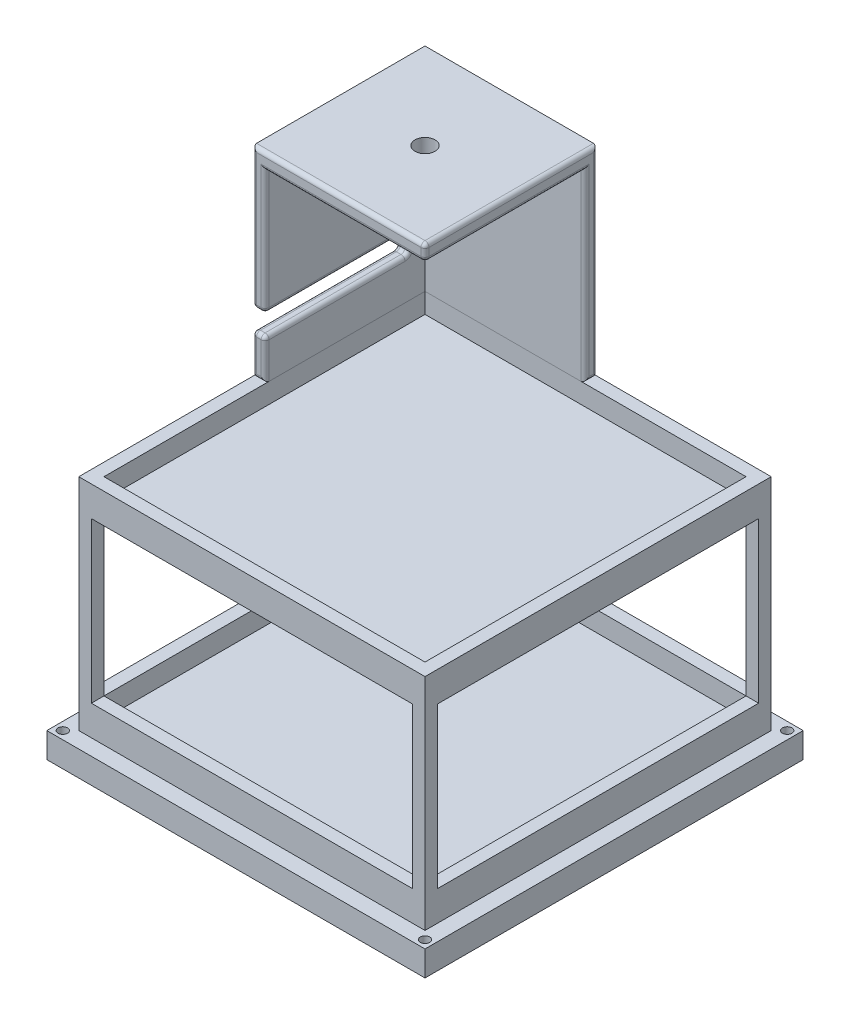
SolidWorks part; units mm, degrees
ref_plane "Front Plane" through (0, 0, 0) normal (0, 0, 1) x (1, 0, 0)
ref_plane "Top Plane" through (0, 0, 0) normal (0, 1, 0) x (1, 0, 0)
ref_plane "Right Plane" through (0, 0, 0) normal (1, 0, 0) x (0, 0, -1)
sketch "Sketch1" plane through (0, 0, 0) normal (0, 1, 0) x (1, 0, 0)
  line L1 (-55, -55) -> (55, -55)
  line L2 (-55, -55) -> (-55, 55)
  line L3 (-55, 55) -> (55, 55)
  line L4 (55, -55) -> (55, 55)
  line L5 (-55, -55) -> (55, 55) construction
  line L6 (-55, 55) -> (55, -55) construction
  point P0 (0, 0)
  dimension "D1" = 110
  dimension "D2" = 110
extrude "Boss-Extrude1" add sketch "Sketch1" along normal blind 9.525
sketch "Sketch3" plane through (0, 0, 0) normal (0, -1, 0) x (1, 0, 0)
  line L0 (55, 55) -> (55, -55) construction
  line L1 (-60.08, -60.08) -> (60.08, -60.08)
  line L2 (-60.08, -60.08) -> (-60.08, 60.08)
  line L3 (-60.08, 60.08) -> (60.08, 60.08)
  line L4 (60.08, -60.08) -> (60.08, 60.08)
  line L5 (-60.08, -60.08) -> (60.08, 60.08) construction
  line L6 (-60.08, 60.08) -> (60.08, -60.08) construction
  line L7 (-55, 55) -> (55, 55) construction
  point P0 (0, 0)
  dimension "D1" = 5.08
  dimension "D2" = 5.08
extrude "Boss-Extrude2" add sketch "Sketch3" along normal blind 8
sketch "Sketch4" plane through (0, 0, 0) normal (0, 1, 0) x (1, 0, 0)
  line L0 (-60.08, 60.08) -> (-55, 60.08) construction
  line L1 (-55, 55) -> (-55, 60.08) construction
  line L2 (-60.08, 60.08) -> (60.08, 60.08) construction
  line L3 (0, -5.2388) -> (0, 5.2388) construction
  line L4 (55, 55) -> (55, 60.08) construction
  line L5 (60.08, 60.08) -> (55, 60.08) construction
  line L6 (-5.2388, 0) -> (5.2388, 0) construction
  line L7 (60.08, -60.08) -> (55, -60.08) construction
  line L8 (55, -55) -> (55, -60.08) construction
  line L9 (-55, -55) -> (-55, -60.08) construction
  line L10 (-60.08, -60.08) -> (-55, -60.08) construction
  circle A0 centre (-57.54, 57.54) radius 1.5
  circle A1 centre (57.54, 57.54) radius 1.5
  circle A2 centre (57.54, -57.54) radius 1.5
  circle A3 centre (-57.54, -57.54) radius 1.5
  point P10 (-57.54, 60.08)
  point P11 (-55, 57.54)
  dimension "D1" = 3
extrude "Cut-Extrude2" cut sketch "Sketch4" against normal through all
sketch "Sketch2" plane through (0, 9.525, 0) normal (0, 1, 0) x (1, 0, 0)
  line L1 (-51, -51) -> (51, -51)
  line L2 (-51, -51) -> (-51, 51)
  line L3 (-51, 51) -> (51, 51)
  line L4 (51, -51) -> (51, 51)
  line L5 (-51, -51) -> (51, 51) construction
  line L6 (-51, 51) -> (51, -51) construction
  point P0 (0, 0)
  dimension "D1" = 102
  dimension "D2" = 102
extrude "Cut-Extrude1" cut sketch "Sketch2" against normal blind 6.35
sketch "Sketch5" plane through (0, 9.525, 0) normal (0, 1, 0) x (1, 0, 0)
  line L0 (-5.2388, 0) -> (5.2388, 0) construction
  line L1 (-55, 55) -> (-51, 55)
  line L2 (-55, 55) -> (-55, 51)
  line L3 (-55, 51) -> (-51, 51)
  line L4 (-51, 55) -> (-51, 51)
  line L5 (-55, -51) -> (-51, -51)
  line L6 (-51, -55) -> (-51, -51)
  line L7 (-55, -55) -> (-51, -55)
  line L8 (-55, -55) -> (-55, -51)
  line L9 (0, -5.2388) -> (0, 5.2388) construction
  line L10 (55, -55) -> (55, -51)
  line L11 (55, -55) -> (51, -55)
  line L12 (51, -55) -> (51, -51)
  line L13 (55, -51) -> (51, -51)
  line L14 (55, 51) -> (51, 51)
  line L15 (51, 55) -> (51, 51)
  line L16 (55, 55) -> (51, 55)
  line L17 (55, 55) -> (55, 51)
extrude "Boss-Extrude3" add sketch "Sketch5" along normal blind 50.8
sketch "Sketch6" plane through (0, 60.325, 0) normal (0, 1, 0) x (1, 0, 0)
  line L1 (-55, 55) -> (55, 55)
  line L2 (-55, 55) -> (-55, -55)
  line L3 (-55, -55) -> (55, -55)
  line L4 (55, 55) -> (55, -55)
extrude "Boss-Extrude4" add sketch "Sketch6" along normal blind 9.525
sketch "Sketch7" plane through (0, 69.85, 0) normal (0, 1, 0) x (1, 0, 0)
  line L8 (-51, -51) -> (51, -51)
  line L9 (-51, -51) -> (-51, 51)
  line L10 (-51, 51) -> (51, 51)
  line L11 (51, -51) -> (51, 51)
  line L12 (-51, -51) -> (51, 51) construction
  line L13 (-51, 51) -> (51, -51) construction
  point P0 (0, 0)
  dimension "D1" = 102
  dimension "D2" = 102
extrude "Cut-Extrude3" cut sketch "Sketch7" against normal blind 6.35
sketch "Sketch8" plane through (0, 69.85, 0) normal (0, 1, 0) x (1, 0, 0)
  line L0 (-55, 0.2) -> (-51, 0.2)
  line L1 (-51, 51) -> (-51, -51) construction
  line L2 (-51, 0.2) -> (-51, 51)
  line L3 (-51, 51) -> (-0.2, 51)
  line L4 (-55, 55) -> (-55, -55)
  line L5 (-55, -55) -> (55, -55)
  line L6 (55, -55) -> (55, 55)
  line L7 (55, 55) -> (-55, 55)
  line L8 (-55, 55) -> (-55, 0.2)
  line L11 (-0.2, 55) -> (-55, 55)
  line L12 (51, 51) -> (-51, 51) construction
  line L13 (-0.2, 51) -> (-0.2, 55)
  dimension "D2" = 50.8
  dimension "D3" = 50.8
  dimension "D1" = 0
extrude "Boss-Extrude5" add sketch "Sketch8" along normal blind 63.5 separate body
sketch "Sketch10" plane through (0, 133.35, 0) normal (0, 1, 0) x (1, 0, 0)
  line L0 (-0.2, 51) -> (-0.2, 55) construction
  line L1 (-55, 55) -> (-0.2, 55)
  line L2 (-55, 55) -> (-55, 0.2)
  line L3 (-55, 0.2) -> (-0.2, 0.2)
  line L4 (-0.2, 55) -> (-0.2, 0.2)
  line L5 (-55, 0.2) -> (-51, 0.2) construction
extrude "Boss-Extrude6" add sketch "Sketch10" against normal blind 5
sketch "Sketch11" plane through (0, 133.35, 0) normal (0, 1, 0) x (1, 0, 0)
  line L0 (-0.2, 55) -> (-55, 55) construction
  line L1 (-0.2, 0.2) -> (-0.2, 55) construction
  circle A0 centre (-27.6, 27.6) radius 3.175
  point P4 (-27.6, 55)
  point P7 (-0.2, 27.6)
  dimension "D1" = 6.35
extrude "Cut-Extrude9" cut sketch "Sketch11" against normal up to next
sketch "Sketch12" plane through (0, 0, -0.2) normal (0, 0, 1) x (1, 0, 0)
  line L0 (-55, 133.35) -> (-55, 69.85) construction
  line L1 (-55, 88.9) -> (-51, 88.9)
  line L2 (-55, 88.9) -> (-55, 82.55)
  line L3 (-55, 82.55) -> (-51, 82.55)
  line L4 (-51, 88.9) -> (-51, 82.55)
  line L5 (-51, 128.35) -> (-51, 69.85) construction
  line L6 (-55, 69.85) -> (-51, 69.85) construction
  dimension "D1" = 6.35
  dimension "D2" = 12.7
extrude "Cut-Extrude10" cut sketch "Sketch12" against normal blind 45.72
fillet "Fillet1" radius 1.27 10 edges at (-51, 88.9, -23.06) (-55, 88.9, -23.06) (-53, 88.9, -0.2) (-55, 82.55, -23.06) (-51, 82.55, -23.06) (-53, 82.55, -0.2) (-53, 88.9, -45.92) (-51, 85.725, -45.92) (-53, 82.55, -45.92) (-55, 85.725, -45.92)
fillet "Fillet2" radius 1.27 17 edges at (-54.628, 82.178, -0.572) (-51.372, 82.178, -0.572) (-51.372, 89.272, -0.572) (-54.628, 89.272, -0.572) (-53, 69.85, -0.2) (-55, 75.565, -0.2) (-51, 75.565, -0.2) (-0.2, 101.6, -55) (-0.2, 69.85, -53) (-0.2, 99.1, -51) (-0.2, 128.35, -25.6) (-0.2, 133.35, -27.6) (-27.6, 133.35, -0.2) (-0.2, 130.85, -0.2) (-25.6, 128.35, -0.2) (-51, 109.26, -0.2) (-55, 111.76, -0.2)
